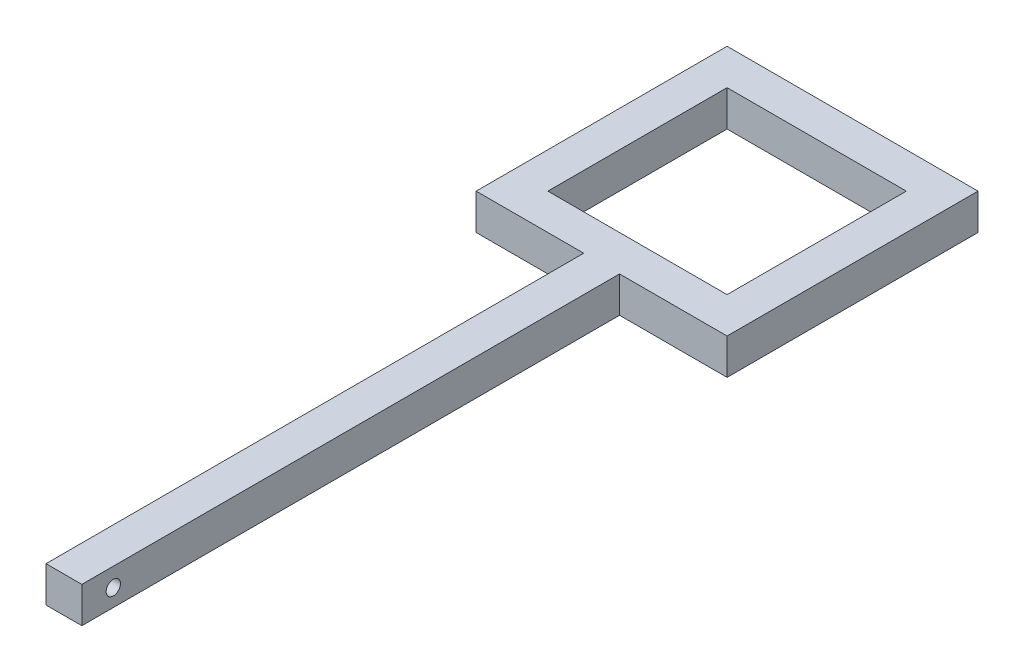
SolidWorks part; units mm, degrees
ref_plane "Front Plane" through (0, 0, 0) normal (0, 0, 1) x (1, 0, 0)
ref_plane "Top Plane" through (0, 0, 0) normal (0, 1, 0) x (1, 0, 0)
ref_plane "Right Plane" through (0, 0, 0) normal (1, 0, 0) x (0, 0, -1)
sketch "Sketch1" plane through (0, 0, 0) normal (0, 1, 0) x (1, 0, 0)
  line L1 (0, 0) -> (20, 0)
  line L2 (0, 0) -> (0, 300)
  line L3 (0, 300) -> (20, 300)
  line L4 (20, 0) -> (20, 300)
  dimension "D1" = 300
  dimension "D2" = 20
extrude "Boss-Extrude1" add sketch "Sketch1" along normal blind 20
sketch "Sketch2" plane through (0, 0, -300) normal (0, 0, -1) x (-1, 0, 0)
  line L0 (-20, 20) -> (0, 0) construction
  line L5 (0, 0) -> (0, 20) construction
  line L6 (0, 20) -> (-20, 0) construction
  line L8 (-80, 0) -> (60, 0)
  line L9 (-80, 0) -> (-80, 20)
  line L10 (-80, 20) -> (60, 20)
  line L11 (60, 0) -> (60, 20)
  line L12 (-80, 0) -> (60, 20) construction
  line L13 (-80, 20) -> (60, 0) construction
  point P3 (-10, 10)
  dimension "D1" = 140
  dimension "D2" = 20
extrude "Boss-Extrude2" add sketch "Sketch2" along normal blind 20
sketch "Sketch3" plane through (0, 0, -320) normal (0, 0, -1) x (-1, 0, 0)
  line L0 (60, 20) -> (-80, 20) construction
  line L1 (-80, 0) -> (-60, 0)
  line L2 (-80, 0) -> (-80, 20)
  line L3 (-80, 20) -> (-60, 20)
  line L4 (-60, 0) -> (-60, 20)
  line L6 (60, 0) -> (40, 0)
  line L7 (60, 0) -> (60, 20)
  line L8 (60, 20) -> (40, 20)
  line L9 (40, 0) -> (40, 20)
  dimension "D1" = 20
  dimension "D2" = 20
extrude "Boss-Extrude3" add sketch "Sketch3" along normal blind 100
sketch "Sketch4" plane through (0, 0, -420) normal (0, 0, -1) x (-1, 0, 0)
  line L1 (-80, 0) -> (60, 0)
  line L2 (-80, 0) -> (-80, 20)
  line L3 (-80, 20) -> (60, 20)
  line L4 (60, 0) -> (60, 20)
extrude "Boss-Extrude4" add sketch "Sketch4" along normal blind 20
sketch "Sketch5" plane through (20, 0, 0) normal (1, 0, 0) x (0, 0, -1)
  circle A0 centre (17.5536, 9.6392) radius 4
  dimension "D1" = 8
extrude "Cut-Extrude1" cut sketch "Sketch5" against normal blind 20
